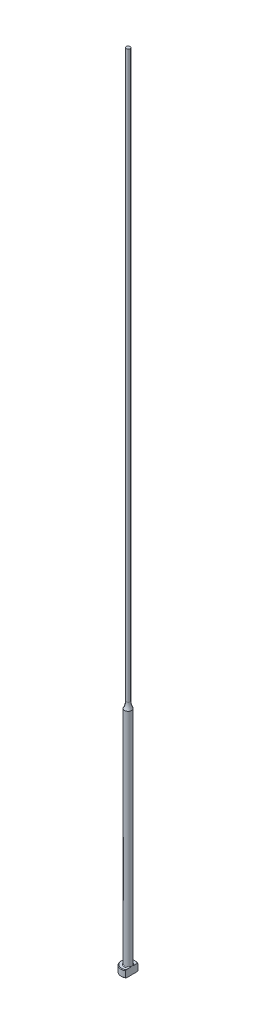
SolidWorks part; units mm, degrees
ref_plane "Front Plane" through (0, 0, 0) normal (0, 0, 1) x (1, 0, 0)
ref_plane "Top Plane" through (0, 0, 0) normal (0, 1, 0) x (1, 0, 0)
ref_plane "Right Plane" through (0, 0, 0) normal (1, 0, 0) x (0, 0, -1)
sketch "Sketch1" plane through (0, 0, 0) normal (0, 0, 1) x (1, 0, 0)
  line L0 (0, 259.9588) -> (0, -15.1925) construction
  line L1 (0, 0) -> (-3.175, 0)
  line L2 (-3.175, 0) -> (-3.175, 3.175)
  line L3 (-3.175, 3.175) -> (-1.5875, 3.175)
  line L4 (-0.8572, 104.5565) -> (-0.8572, 355.6)
  line L5 (-0.8572, 355.6) -> (0, 355.6)
  line L6 (0, 355.6) -> (0, 0)
  line L7 (-1.5875, 3.175) -> (-1.5875, 101.6)
  arc A0 (-1.5875, 101.6) -> (-0.8572, 104.5565) centre (-7.2072, 104.5565) ccw
  point P13 (-1.5875, 0)
  dimension "D1" = 6.35
  dimension "L" = 355.6
  dimension "D2" = 3.175
  dimension "H" = 6.35
  dimension "T" = 3.175
  dimension "D" = 1.7145
  dimension "S" = 101.6
revolve "Revolve1" add sketch "Sketch1" angle 360 about L0
chamfer "Chamfer1" distance 0.254 angle 45 2 edges at (0, 3.175, 3.175) (0, 0, 3.175)
fillet "Fillet1" radius 0.254 1 edges at (0, 3.175, 1.5875)
sketch "Sketch2" plane through (0, 0, 0) normal (0, 1, 0) x (1, 0, 0)
  line L0 (1.5875, -2.7496) -> (1.5875, 2.7496)
  circle A0 centre (0, 0) radius 3.175 construction
  arc A2 (1.5875, -2.7496) -> (1.5875, 2.7496) centre (0, 0) ccw
  circle A3 centre (0, 0) radius 3.175 construction
  circle A4 centre (0, 0) radius 1.5875 construction
extrude "Key Head" cut sketch "Sketch2" along normal up to next
